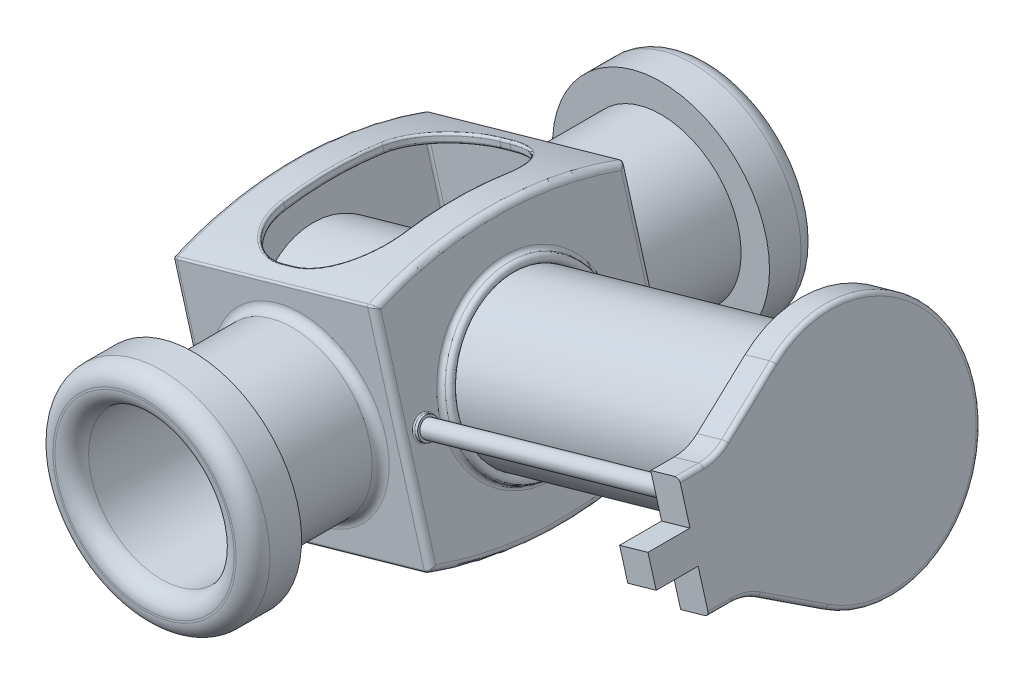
SolidWorks part; units mm, degrees
ref_plane "Plan de face" through (0, 0, 0) normal (0, 0, 1) x (1, 0, 0)
ref_plane "Plan de dessus" through (0, 0, 0) normal (0, 1, 0) x (1, 0, 0)
ref_plane "Plan de droite" through (0, 0, 0) normal (1, 0, 0) x (0, 0, -1)
imported_body "Importée3"
imported_body "Importée5"
ref_plane "Plan1" through (-29.4297, 103.8399, 0) normal (0.2727, -0.9621, 0) x (-0.9621, -0.2727, 0)
sketch "Esquisse1" plane through (-29.4297, 103.8399, 0) normal (0.2727, -0.9621, 0) x (-0.9621, -0.2727, 0)
  line L1 (-381.9312, -930.5) -> (-276.9312, -930.5)
  line L2 (-381.9312, -930.5) -> (-381.9312, -945.5)
  line L3 (-381.9312, -945.5) -> (-115.3955, -945.5)
  line L4 (-276.9312, -930.5) -> (-276.9312, -937.5)
  line L5 (-246.9312, -937.5) -> (-276.9312, -937.5)
  line L6 (-165.0279, -937.5) -> (-263.9312, -937.5) construction
  line L7 (-246.9312, -937.5) -> (-246.9312, -921.5)
  line L8 (-246.9312, -921.5) -> (-115.3955, -921.5)
  line L9 (-115.3955, -921.5) -> (-115.3955, -945.5)
  line L10 (-261.9312, -974) -> (-261.9312, -917) construction
  line L11 (-393.9312, -919.1473) -> (-393.9312, -959.4304) construction
  line L12 (-378.9967, -945.5) -> (-420.8001, -945.5) construction
  line L13 (-150.3955, -938.8155) -> (-150.3955, -958.869) construction
  dimension "D1" = 15
  dimension "D2" = 15
  dimension "D3" = 12
  dimension "D4" = 15
  dimension "D5" = 35
  dimension "D6" = 24
revolve "Enlèvement de matière-Révolution1" cut sketch "Esquisse1" angle 360 about L3
sketch "Esquisse2" plane through (252.0057, 71.4219, 0) normal (-0.9621, -0.2727, 0) x (0, 0, 1)
  circle A0 centre (945.5, 107.9298) radius 11
  dimension "D1" = 22
extrude "Enlèv. mat.-Extru.2" cut sketch "Esquisse2" against normal blind 4.2
